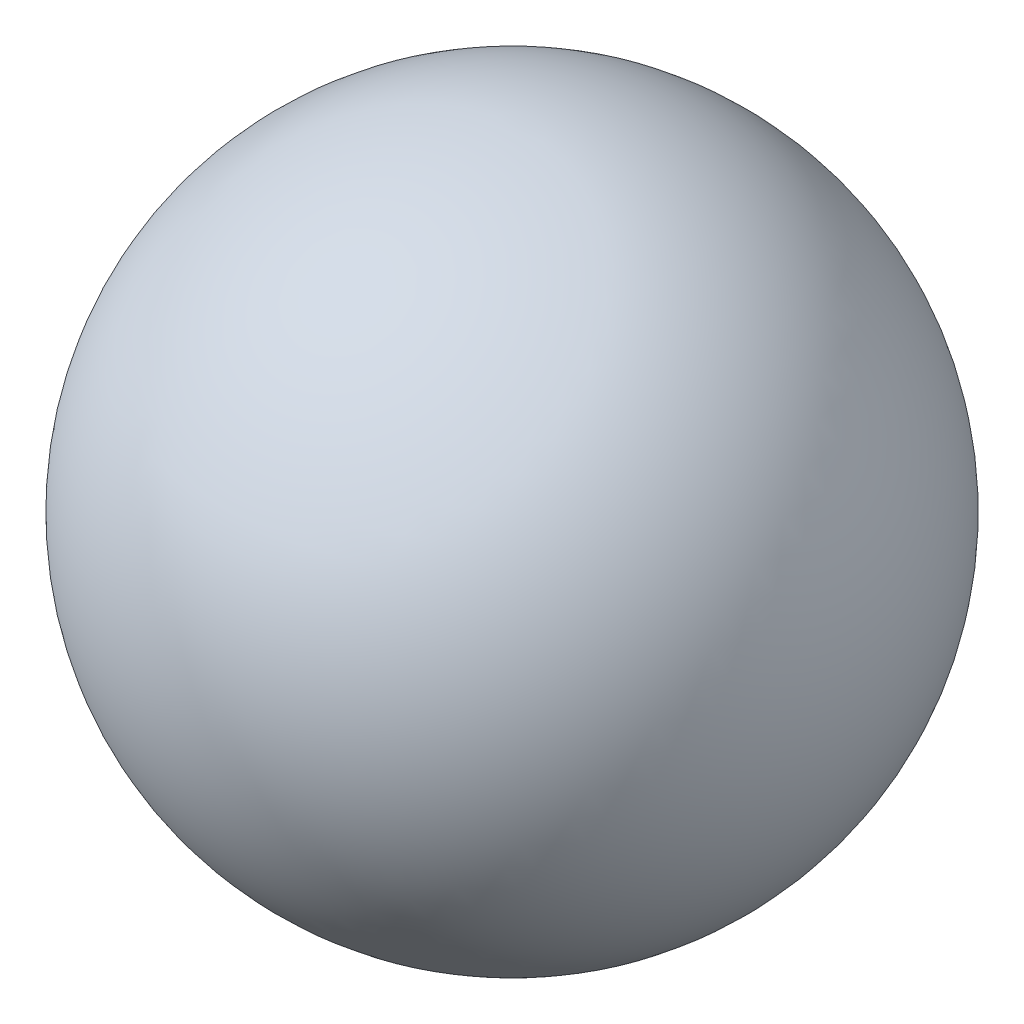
SolidWorks part; units mm, degrees
ref_plane "Přední" through (0, 0, 0) normal (0, 0, 1) x (1, 0, 0)
ref_plane "Horní" through (0, 0, 0) normal (0, 1, 0) x (1, 0, 0)
ref_plane "Pravá" through (0, 0, 0) normal (1, 0, 0) x (0, 0, -1)
sketch "Skica1" plane through (0, 0, 0) normal (0, 0, 1) x (1, 0, 0)
  line L0 (0, 48.875) -> (0, -48.875)
  arc A0 (0, 48.875) -> (0, -48.875) centre (0, 0) ccw
  dimension "D1" = 48.875
revolve "Otočit kolem osy1" add sketch "Skica1" angle 360 about L0
